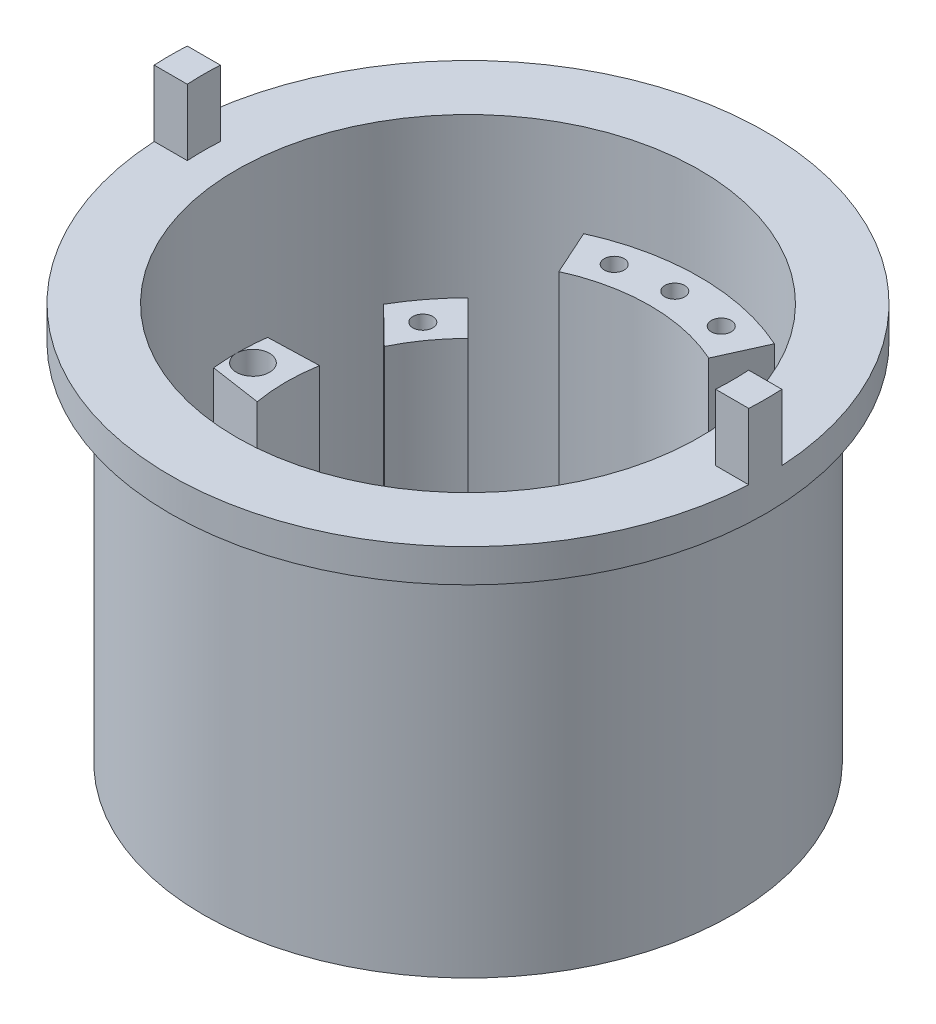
SolidWorks part; units mm, degrees
ref_plane "Front Plane" through (0, 0, 0) normal (0, 0, 1) x (1, 0, 0)
ref_plane "Top Plane" through (0, 0, 0) normal (0, 1, 0) x (1, 0, 0)
ref_plane "Right Plane" through (0, 0, 0) normal (1, 0, 0) x (0, 0, -1)
sketch "Sketch1" plane through (0, 0, 0) normal (0, 1, 0) x (1, 0, 0)
  circle A0 centre (0, 0) radius 40
extrude "Boss-Extrude1" add sketch "Sketch1" along normal blind 5
sketch "Sketch2" plane through (0, 5, 0) normal (0, 1, 0) x (1, 0, 0)
  line L0 (0, -10.0662) -> (7.1179, -7.1179)
  line L1 (10.0662, 0) -> (7.1179, 7.1179)
  line L2 (7.1179, 7.1179) -> (0, 10.0662)
  line L3 (0, 10.0662) -> (-7.1179, 7.1179)
  line L4 (-7.1179, 7.1179) -> (-10.0662, 0)
  line L5 (-10.0662, 0) -> (-7.1179, -7.1179)
  line L6 (-7.1179, -7.1179) -> (0, -10.0662)
  line L7 (7.1179, -7.1179) -> (10.0662, 0)
  circle A0 centre (0, 0) radius 9.3 construction
extrude "Cut-Extrude1" cut sketch "Sketch2" against normal blind 5
sketch "Sketch3" plane through (0, 5, 0) normal (0, 1, 0) x (1, 0, 0)
  circle A0 centre (0, 0) radius 40
  circle A1 centre (0, 0) radius 35
extrude "Boss-Extrude2" add sketch "Sketch3" along normal blind 50
sketch "Sketch4" plane through (0, 5, 0) normal (0, 1, 0) x (1, 0, 0)
  line L2 (-19.4454, 19.4454) -> (-24.7487, 24.7487)
  line L3 (19.4454, -19.4454) -> (24.7487, -24.7487)
  line L4 (-19.4454, -19.4454) -> (-24.7487, -24.7487)
  line L5 (19.4454, 19.4454) -> (24.7487, 24.7487)
  arc A0 (-19.4454, 19.4454) -> (-19.4454, -19.4454) centre (0, 0) ccw
  arc A1 (-24.7487, 24.7487) -> (-24.7487, -24.7487) centre (0, 0) ccw
  arc A2 (19.4454, -19.4454) -> (19.4454, 19.4454) centre (0, 0) ccw
  arc A3 (24.7487, -24.7487) -> (24.7487, 24.7487) centre (0, 0) ccw
  point P5 (-24.7487, 24.7487)
  point P6 (-19.4454, 19.4454)
  point P7 (-19.4454, -19.4454)
  point P13 (-24.7487, -24.7487)
  point P15 (19.4454, -19.4454)
  point P17 (24.7487, -24.7487)
  point P19 (19.4454, 19.4454)
  point P20 (24.7487, 24.7487)
extrude "Boss-Extrude4" add sketch "Sketch4" along normal blind 31
sketch "Sketch5" plane through (0, 36, 0) normal (0, 1, 0) x (1, 0, 0)
  circle A1 centre (-32.5, 0) radius 2.5
extrude "Cut-Extrude2" cut sketch "Sketch5" against normal blind 36
sketch "Sketch7" plane through (0, 5, 0) normal (0, 1, 0) x (1, 0, 0)
  line L0 (-14.4105, 31.8957) -> (-11.3225, 25.0609)
  line L1 (14.4105, 31.8957) -> (11.3225, 25.0609)
  line L2 (-11.3225, -25.0609) -> (-14.4105, -31.8957)
  line L3 (11.3225, -25.0609) -> (14.4105, -31.8957)
  arc A0 (-11.3225, -25.0609) -> (11.3225, -25.0609) centre (0, 0) ccw
  arc A1 (-14.4105, -31.8957) -> (14.4105, -31.8957) centre (0, 0) ccw
  arc A2 (11.3225, 25.0609) -> (-11.3225, 25.0609) centre (0, 0) ccw
  arc A3 (14.4105, 31.8957) -> (-14.4105, 31.8957) centre (0, 0) ccw
extrude "Boss-Extrude5" add sketch "Sketch7" along normal blind 41
sketch "Sketch8" plane through (0, 36, 0) normal (0, 1, 0) x (1, 0, 0)
  circle A0 centre (30.8799, 0) radius 1.5
  circle A1 centre (24.9823, -18.1507) radius 1.5
  circle A4 centre (-24.9823, -18.1507) radius 1.5
  circle A6 centre (-24.9823, 18.1507) radius 1.5
  circle A9 centre (24.9823, 18.1507) radius 1.5
  circle A10 centre (-9.5424, 29.3685) radius 1.5
  circle A11 centre (9.5424, 29.3685) radius 1.5
  circle A12 centre (9.5424, -29.3685) radius 1.5
  circle A13 centre (-9.5424, -29.3685) radius 1.5
  circle A14 centre (-30.8799, 0) radius 1.5
  point P23 (0, 0)
  dimension "D1" = 10
extrude "Cut-Extrude3" cut sketch "Sketch8" against normal blind 25
sketch "Sketch9" plane through (0, 46, 0) normal (0, 1, 0) x (1, 0, 0)
  circle A2 centre (0, 31.25) radius 1.5
  circle A3 centre (8.0881, 30.1852) radius 1.5
  circle A13 centre (8.0881, -30.1852) radius 1.5
  circle A14 centre (0, -31.25) radius 1.5
  circle A15 centre (-8.0881, -30.1852) radius 1.5
  circle A25 centre (-8.0881, 30.1852) radius 1.5
  circle A26 centre (-15.625, -27.0633) radius 1.5
  circle A27 centre (-22.0971, -22.0971) radius 1.5
  circle A28 centre (-27.0633, -15.625) radius 1.5
  circle A29 centre (-30.1852, -8.0881) radius 1.5
  circle A30 centre (-31.25, 0) radius 1.5
  circle A31 centre (-30.1852, 8.0881) radius 1.5
  circle A32 centre (-27.0633, 15.625) radius 1.5
  circle A33 centre (-22.0971, 22.0971) radius 1.5
  circle A34 centre (-15.625, 27.0633) radius 1.5
  circle A35 centre (15.625, 27.0633) radius 1.5
  circle A36 centre (22.0971, 22.0971) radius 1.5
  circle A37 centre (27.0633, 15.625) radius 1.5
  circle A38 centre (30.1852, 8.0881) radius 1.5
  circle A39 centre (31.25, 0) radius 1.5
  circle A40 centre (30.1852, -8.0881) radius 1.5
  circle A41 centre (27.0633, -15.625) radius 1.5
  circle A42 centre (22.0971, -22.0971) radius 1.5
  circle A43 centre (15.625, -27.0633) radius 1.5
  point P58 (0, 0)
  dimension "D1" = 24
extrude "Cut-Extrude4" cut sketch "Sketch9" against normal blind 30
sketch "Sketch13" plane through (0, 55, 0) normal (0, 1, 0) x (1, 0, 0)
  circle A0 centre (0, 0) radius 35
  circle A1 centre (0, 0) radius 45
extrude "Boss-Extrude6" add sketch "Sketch13" along normal blind 5
sketch "Sketch14" plane through (0, 60, 0) normal (0, 1, 0) x (1, 0, 0)
  line L1 (-44.9305, 2.5) -> (-39.9218, 2.5)
  line L3 (-44.9305, -2.5) -> (-39.9218, -2.5)
  line L7 (39.9218, 2.5) -> (44.9305, 2.5)
  line L9 (39.9218, -2.5) -> (44.9305, -2.5)
  arc A0 (-44.9305, 2.5) -> (-44.9305, -2.5) centre (0, 0) ccw
  arc A1 (-39.9218, 2.5) -> (-39.9218, -2.5) centre (0, 0) ccw
  arc A2 (44.9305, -2.5) -> (44.9305, 2.5) centre (0, 0) ccw
  arc A3 (39.9218, -2.5) -> (39.9218, 2.5) centre (0, 0) ccw
  point P4 (-42.6035, 0)
  point P9 (42.409, 0)
extrude "Boss-Extrude7" add sketch "Sketch14" along normal blind 10
sketch "Sketch15" plane through (0, 36, 0) normal (0, 1, 0) x (1, 0, 0)
  line L0 (24.6706, 12.1496) -> (30.6939, 16.8193)
  line L1 (27.0832, 4.7695) -> (34.8114, 3.6286)
  line L2 (24.7142, -12.0605) -> (30.2959, -17.526)
  line L3 (27.1003, -4.6717) -> (34.718, -4.4343)
  line L10 (-27.0832, -4.7695) -> (-34.8114, -3.6286)
  line L11 (-24.6706, -12.1496) -> (-30.6939, -16.8193)
  line L12 (-24.7142, 12.0605) -> (-30.2959, 17.526)
  line L13 (-27.1003, 4.6717) -> (-34.718, 4.4343)
  line L20 (3.8331, 27.2315) -> (7.3063, 34.2289)
  line L21 (-3.9314, 27.2175) -> (-6.5111, 34.389)
  line L22 (19.1074, 19.7777) -> (26.0302, 23.3972)
  line L23 (12.8175, 24.3303) -> (14.9457, 31.6485)
  line L24 (12.9052, -24.2838) -> (14.2083, -31.9863)
  line L25 (19.1786, -19.7086) -> (25.481, -23.9942)
  line L26 (-3.8331, -27.2315) -> (-7.3063, -34.2289)
  line L27 (3.9314, -27.2175) -> (6.5111, -34.389)
  line L28 (-12.9052, 24.2838) -> (-14.2083, 31.9863)
  line L29 (-19.1786, 19.7086) -> (-25.481, 23.9942)
  line L30 (-19.1074, -19.7777) -> (-26.0302, -23.3972)
  line L31 (-12.8175, -24.3303) -> (-14.9457, -31.6485)
  arc A0 (34.8114, 3.6286) -> (30.6939, 16.8193) centre (0, 0) ccw
  arc A1 (24.7487, -24.7487) -> (24.7487, 24.7487) centre (0, 0) ccw construction
  arc A2 (24.6706, 12.1496) -> (27.0832, 4.7695) centre (0, 0) cw
  arc A3 (19.4454, -19.4454) -> (19.4454, 19.4454) centre (0, 0) ccw construction
  arc A4 (30.2959, -17.526) -> (34.718, -4.4343) centre (0, 0) ccw
  arc A5 (27.1003, -4.6717) -> (24.7142, -12.0605) centre (0, 0) cw
  arc A12 (-34.8114, -3.6286) -> (-30.6939, -16.8193) centre (0, 0) ccw
  arc A13 (-24.6706, -12.1496) -> (-27.0832, -4.7695) centre (0, 0) cw
  arc A14 (-30.2959, 17.526) -> (-34.718, 4.4343) centre (0, 0) ccw
  arc A15 (-27.1003, 4.6717) -> (-24.7142, 12.0605) centre (0, 0) cw
  arc A22 (7.3063, 34.2289) -> (-6.5111, 34.389) centre (0, 0) ccw
  arc A23 (-3.9314, 27.2175) -> (3.8331, 27.2315) centre (0, 0) cw
  arc A24 (26.0302, 23.3972) -> (14.9457, 31.6485) centre (0, 0) ccw
  arc A25 (12.8175, 24.3303) -> (19.1074, 19.7777) centre (0, 0) cw
  arc A26 (14.2083, -31.9863) -> (25.481, -23.9942) centre (0, 0) ccw
  arc A27 (19.1786, -19.7086) -> (12.9052, -24.2838) centre (0, 0) cw
  arc A28 (-7.3063, -34.2289) -> (6.5111, -34.389) centre (0, 0) ccw
  arc A29 (3.9314, -27.2175) -> (-3.8331, -27.2315) centre (0, 0) cw
  arc A30 (-14.2083, 31.9863) -> (-25.481, 23.9942) centre (0, 0) ccw
  arc A31 (-19.1786, 19.7086) -> (-12.9052, 24.2838) centre (0, 0) cw
  arc A32 (-26.0302, -23.3972) -> (-14.9457, -31.6485) centre (0, 0) ccw
  arc A33 (-12.8175, -24.3303) -> (-19.1074, -19.7777) centre (0, 0) cw
  point P50 (0, 0)
  dimension "D1" = 10
extrude "Cut-Extrude5" cut sketch "Sketch15" against normal blind 31
